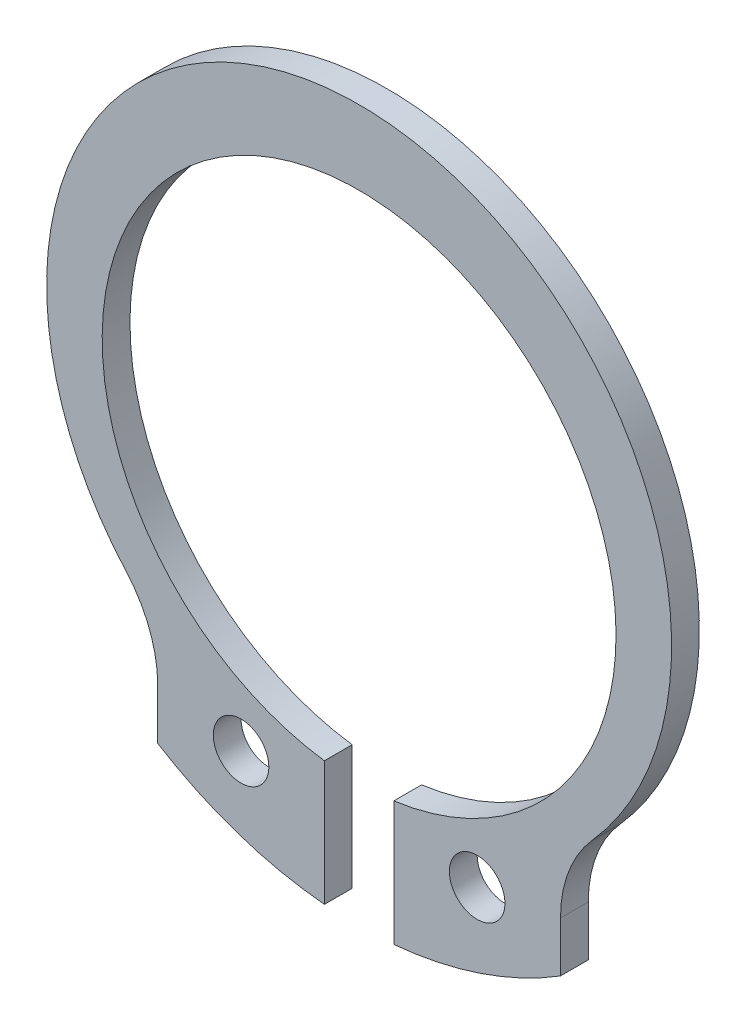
SolidWorks part; units mm, degrees
ref_plane "Front" through (0, 0, 0) normal (0, 0, 1) x (1, 0, 0)
ref_plane "Top" through (0, 0, 0) normal (0, 1, 0) x (1, 0, 0)
ref_plane "Right" through (0, 0, 0) normal (1, 0, 0) x (0, 0, -1)
other "Configuration Table"
sketch "Sketch1" plane through (0, 0, 0) normal (0, 0, 1) x (1, 0, 0)
  line L0 (0, 4.2365) -> (0, -4.2365) construction
  line L1 (-1.25, -14.3129) -> (-1.25, -9.8352)
  line L2 (1.25, -14.3129) -> (1.25, -9.8352)
  line L3 (-4.25, -3.2292) -> (-4.25, -11.0323) construction
  line L4 (-7.25, -8.6023) -> (-7.25, -12.2944)
  line L5 (7.25, -8.6023) -> (7.25, -12.2944)
  line L6 (4.25, -3.2292) -> (4.25, -11.0323) construction
  line L7 (11.2, -0.67) -> (-11.2, -0.67) construction
  line L8 (0, -0.67) -> (-1.8514, -14.2443) construction
  arc A0 (1.25, -9.8352) -> (-1.25, -9.8352) centre (0, -0.67) ccw
  arc A1 (7.25, -8.6023) -> (-7.25, -8.6023) centre (0, 0) ccw
  arc A2 (-11.2, -0.67) -> (11.2, -0.67) centre (0, -0.67) ccw construction
  circle A3 centre (-4.25, -11.0323) radius 1
  arc A4 (-7.25, -12.2944) -> (-1.25, -14.3129) centre (0, -0.67) ccw
  circle A5 centre (4.25, -11.0323) radius 1
  arc A6 (7.25, -12.2944) -> (1.25, -14.3129) centre (0, -0.67) cw
  dimension "d0" = 18.5
  dimension "D" = 22.5
  dimension "d1" = 2
  dimension "R1" = 11.2
  dimension "B1" = 2.5
  dimension "c" = 0.67
  dimension "L" = 14.5
  dimension "B2" = 8.5
  dimension "a" = 4.45
extrude "Body" add sketch "Sketch1" against normal blind 1
fillet "Fillet1" radius 4.5 2 edges at (-7.25, -8.6023, -0.5) (7.25, -8.6023, -0.5)
